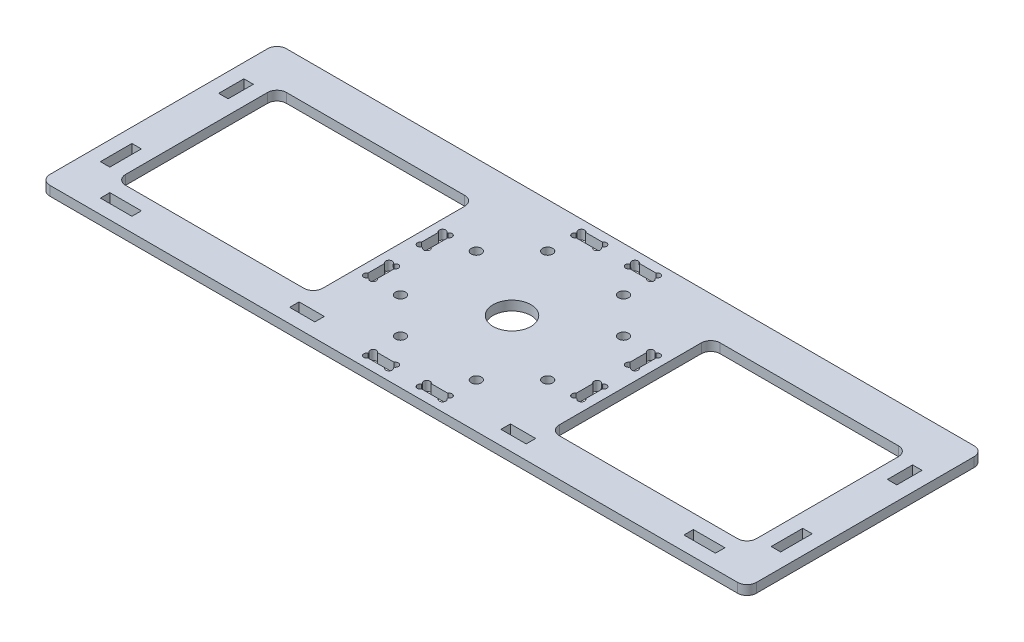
SolidWorks part; units mm, degrees
ref_plane "前视基准面" through (0, 0, 0) normal (0, 0, 1) x (1, 0, 0)
ref_plane "上视基准面" through (0, 0, 0) normal (0, 1, 0) x (1, 0, 0)
ref_plane "右视基准面" through (0, 0, 0) normal (1, 0, 0) x (0, 0, -1)
sketch "草图2" plane through (0, 0, 0) normal (0, 1, 0) x (1, 0, 0)
  line L0 (0, 37.5) -> (0, -37.5) construction
  line L1 (-112, -37.5) -> (112, -37.5)
  line L2 (-112, -37.5) -> (-112, 37.5)
  line L3 (-112, 37.5) -> (112, 37.5)
  line L4 (112, -37.5) -> (112, 37.5)
  line L5 (-112, -37.5) -> (112, 37.5) construction
  line L6 (-112, 37.5) -> (112, -37.5) construction
  line L7 (37.5, 37.5) -> (37.5, -37.5) construction
  line L8 (37.5, 25.5) -> (100, 25.5)
  line L9 (37.5, -25.5) -> (100, -25.5)
  line L10 (-112, 0) -> (112, 0) construction
  line L11 (100, 25.5) -> (100, -25.5)
  line L12 (37.5, 25.5) -> (37.5, -25.5)
  line L13 (-37.5, 25.5) -> (-37.5, -25.5)
  line L14 (-100, 25.5) -> (-100, -25.5)
  line L15 (-37.5, -25.5) -> (-100, -25.5)
  line L16 (-37.5, 25.5) -> (-100, 25.5)
  dimension "D1" = 224
  dimension "D2" = 75
  dimension "D3" = 37.5
  dimension "D4" = 12
  dimension "D5" = 12
extrude "凸台-拉伸1" add sketch "草图2" along normal blind 3
fillet "圆角1" radius 3 12 edges at (112, 1.5, -37.5) (112, 1.5, 37.5) (-112, 1.5, 37.5) (-112, 1.5, -37.5) (100, 1.5, -25.5) (100, 1.5, 25.5) (37.5, 1.5, 25.5) (37.5, 1.5, -25.5) (-37.5, 1.5, 25.5) (-100, 1.5, 25.5) (-100, 1.5, -25.5) (-37.5, 1.5, -25.5)
hole_wizard "Ø3.2 (3.2) 直径孔1" positions "草图4" profile "草图5" hole size "Ø3.2" standard "GB"
sketch "草图4" plane through (0, 3, 0) normal (0, 1, 0) x (1, 0, 0)
  line L0 (-112, 0) -> (112, 0) construction
  line L1 (-112, 34.5) -> (-112, -34.5) construction
  line L2 (112, -34.5) -> (112, 34.5) construction
  line L4 (0, 37.5) -> (0, -37.5) construction
  line L5 (109, 37.5) -> (-109, 37.5) construction
  line L6 (-109, -37.5) -> (109, -37.5) construction
  line L7 (-74.1213, 74.1213) -> (74.1213, -74.1213) construction
  line L9 (74.1213, 74.1213) -> (-74.1213, -74.1213) construction
  point P0 (12.0208, -23.3345)
  point P3 (23.3345, -12.0208)
  point P49 (-12.0208, 23.3345)
  point P50 (-23.3345, 12.0208)
  point P51 (23.3345, 12.0208)
  point P52 (12.0208, 23.3345)
  point P53 (-23.3345, -12.0208)
  point P54 (-12.0208, -23.3345)
  dimension "D1" = 16
  dimension "D2" = 50
  dimension "D3" = 45
  dimension "D4" = 45
sketch "草图5" plane through (12.0208, 3, 23.3345) normal (1, 0, 0) x (0, 0, 1)
  line L0 (0, 0) -> (0, 3)
  line L1 (0, 3) -> (1.6, 3)
  line L2 (1.6, 3) -> (1.6, 0)
  line L5 (1.6, 0) -> (0, 0)
  line L11 (0, -6.35) -> (0, 107.95) construction
  dimension "通孔孔直径" = 3.2
  dimension "通孔孔深度" = 3
sketch "草图6" plane through (0, 3, 0) normal (0, 1, 0) x (1, 0, 0)
  circle A0 centre (0, 0) radius 6
  dimension "D1" = 12
extrude "切除-拉伸2" cut sketch "草图6" against normal blind 10
sketch "草图7" plane through (0, 3, 0) normal (0, 1, 0) x (1, 0, 0)
  line L0 (-112, 0) -> (112, 0) construction
  line L1 (-112, 34.5) -> (-112, -34.5) construction
  line L2 (112, -34.5) -> (112, 34.5) construction
  line L3 (0, 37.5) -> (0, -37.5) construction
  line L4 (109, 37.5) -> (-109, 37.5) construction
  line L5 (-109, -37.5) -> (109, -37.5) construction
  line L6 (4.5, 34.5) -> (4.5, 31.5)
  line L7 (-12.5, 34.5) -> (-4.5, 34.5)
  line L8 (-12.5, 34.5) -> (-12.5, 31.5)
  line L9 (-12.5, 31.5) -> (-4.5, 31.5)
  line L10 (-4.5, 34.5) -> (-4.5, 31.5)
  line L11 (12.5, 31.5) -> (4.5, 31.5)
  line L12 (12.5, 34.5) -> (12.5, 31.5)
  line L13 (12.5, 34.5) -> (4.5, 34.5)
  line L14 (12.5, -34.5) -> (4.5, -34.5)
  line L15 (12.5, -34.5) -> (12.5, -31.5)
  line L16 (12.5, -31.5) -> (4.5, -31.5)
  line L17 (-4.5, -34.5) -> (-4.5, -31.5)
  line L18 (-12.5, -31.5) -> (-4.5, -31.5)
  line L19 (-12.5, -34.5) -> (-12.5, -31.5)
  line L20 (-12.5, -34.5) -> (-4.5, -34.5)
  line L21 (4.5, -34.5) -> (4.5, -31.5)
  line L22 (0, 0) -> (37.5, 37.5) construction
  line L23 (34.5, 12.5) -> (34.5, 4.5)
  line L24 (34.5, 12.5) -> (31.5, 12.5)
  line L25 (31.5, 12.5) -> (31.5, 4.5)
  line L26 (34.5, -4.5) -> (31.5, -4.5)
  line L27 (31.5, -12.5) -> (31.5, -4.5)
  line L28 (34.5, -12.5) -> (31.5, -12.5)
  line L29 (34.5, -12.5) -> (34.5, -4.5)
  line L30 (34.5, 4.5) -> (31.5, 4.5)
  line L31 (-34.5, 4.5) -> (-31.5, 4.5)
  line L32 (-34.5, -12.5) -> (-34.5, -4.5)
  line L33 (-34.5, -12.5) -> (-31.5, -12.5)
  line L34 (-31.5, -12.5) -> (-31.5, -4.5)
  line L35 (-34.5, -4.5) -> (-31.5, -4.5)
  line L36 (-31.5, 12.5) -> (-31.5, 4.5)
  line L37 (-34.5, 12.5) -> (-31.5, 12.5)
  line L38 (-34.5, 12.5) -> (-34.5, 4.5)
  dimension "D1" = 69
  dimension "D2" = 3
  dimension "D3" = 9
  dimension "D4" = 25
  dimension "D5" = 45
extrude "切除-拉伸3" cut sketch "草图7" against normal through all and the other way through all
hole_wizard "Ø2.0 (2) 直径孔1" positions "草图8" profile "草图9" hole size "Ø2.0" standard "GB"
sketch "草图8" plane through (0, 3, 0) normal (0, 1, 0) x (1, 0, 0)
  line L0 (-34.5, 12.5) -> (-31.5, 12.5) construction
  line L1 (-34.5, 4.5) -> (-34.5, 12.5) construction
  line L2 (-33, 12.5) -> (-33, 4.5) construction
  line L3 (-31.5, 4.5) -> (-34.5, 4.5) construction
  line L5 (-34.5, 8.5) -> (-31.5, 8.5) construction
  line L6 (-31.5, 12.5) -> (-31.5, 4.5) construction
  line L8 (-37.5, 0) -> (37.5, 0) construction
  line L9 (-37.5, -22.5) -> (-37.5, 22.5) construction
  line L10 (37.5, 22.5) -> (37.5, -22.5) construction
  line L12 (-37.5, 37.5) -> (37.5, -37.5) construction
  line L13 (109, 37.5) -> (-109, 37.5) construction
  line L14 (-109, -37.5) -> (109, -37.5) construction
  point P0 (-34, 12)
  point P20 (-32, 12)
  point P21 (-32, 5)
  point P22 (-34, 5)
  point P39 (-32, -5)
  point P40 (-34, -5)
  point P41 (-32, -12)
  point P42 (-34, -12)
  point P43 (12, 34)
  point P44 (12, 32)
  point P45 (5, 34)
  point P46 (5, 32)
  point P47 (-5, 34)
  point P48 (-5, 32)
  point P49 (-12, 32)
  point P50 (-12, 34)
  point P51 (-12, -34)
  point P52 (-12, -32)
  point P53 (-5, -32)
  point P54 (-5, -34)
  point P55 (5, -32)
  point P56 (5, -34)
  point P57 (12, -32)
  point P58 (12, -34)
  point P59 (34, -12)
  point P60 (32, -12)
  point P61 (34, -5)
  point P62 (32, -5)
  point P63 (34, 5)
  point P64 (32, 5)
  point P65 (32, 12)
  point P66 (34, 12)
  dimension "D1" = 0.5
  dimension "D2" = 0.5
  dimension "D3" = 45
sketch "草图9" plane through (-34, 3, -12) normal (1, 0, 0) x (0, 0, 1)
  line L0 (0, 0) -> (0, 3)
  line L1 (0, 3) -> (1, 3)
  line L2 (1, 3) -> (1, 0)
  line L5 (1, 0) -> (0, 0)
  line L11 (0, -6.35) -> (0, 107.95) construction
  dimension "通孔孔直径" = 2
  dimension "通孔孔深度" = 3
sketch "草图10" plane through (0, 3, 0) normal (0, 1, 0) x (1, 0, 0)
  line L0 (0, 37.5) -> (0, -37.5) construction
  line L1 (109, 37.5) -> (-109, 37.5) construction
  line L2 (-109, -37.5) -> (109, -37.5) construction
  line L3 (-106, 37.5) -> (-106, -37.5) construction
  line L4 (-112, 34.5) -> (-112, -34.5) construction
  line L5 (-112, -31.5) -> (112, -31.5) construction
  line L6 (112, -34.5) -> (112, 34.5) construction
  line L7 (-106, -31.5) -> (-85.1284, -10.6284) construction
  line L8 (-97.5, -30) -> (-87.5, -30)
  line L9 (-97.5, -30) -> (-97.5, -33)
  line L10 (-97.5, -33) -> (-87.5, -33)
  line L11 (-87.5, -30) -> (-87.5, -33)
  line L12 (-104.5, -13) -> (-107.5, -13)
  line L13 (-107.5, -23) -> (-107.5, -13)
  line L14 (-104.5, -23) -> (-107.5, -23)
  line L15 (-104.5, -23) -> (-104.5, -13)
  line L16 (-37.5, -22.5) -> (-37.5, 22.5) construction
  line L17 (-37.5, -30) -> (-29.5, -30)
  line L18 (-37.5, -30) -> (-37.5, -33)
  line L19 (-37.5, -33) -> (-29.5, -33)
  line L20 (-29.5, -30) -> (-29.5, -33)
  line L21 (29.5, -30) -> (29.5, -33)
  line L22 (37.5, -33) -> (29.5, -33)
  line L23 (37.5, -30) -> (37.5, -33)
  line L24 (37.5, -30) -> (29.5, -30)
  line L25 (104.5, -22.334) -> (104.5, -12.334)
  line L26 (104.5, -22.334) -> (107.5, -22.334)
  line L27 (107.5, -22.334) -> (107.5, -12.334)
  line L28 (104.5, -12.334) -> (107.5, -12.334)
  line L29 (87.5, -30) -> (87.5, -33)
  line L30 (97.5, -33) -> (87.5, -33)
  line L31 (97.5, -30) -> (97.5, -33)
  line L32 (97.5, -30) -> (87.5, -30)
  line L33 (104.5, 22.5) -> (104.5, 14.5)
  line L34 (-107.5, 22.5) -> (-104.5, 22.5)
  line L35 (-107.5, 22.5) -> (-107.5, 14.5)
  line L36 (-107.5, 14.5) -> (-104.5, 14.5)
  line L37 (-104.5, 22.5) -> (-104.5, 14.5)
  line L38 (107.5, 14.5) -> (104.5, 14.5)
  line L39 (107.5, 22.5) -> (107.5, 14.5)
  line L40 (107.5, 22.5) -> (104.5, 22.5)
  dimension "D1" = 6
  dimension "D2" = 6
  dimension "D3" = 3
  dimension "D4" = 10
  dimension "D5" = 8.5
  dimension "D6" = 45
  dimension "D7" = 8
  dimension "D8" = 3
  dimension "D9" = 3
  dimension "D10" = 15
  dimension "D11" = 8
extrude "切除-拉伸4" cut sketch "草图10" against normal blind 10
